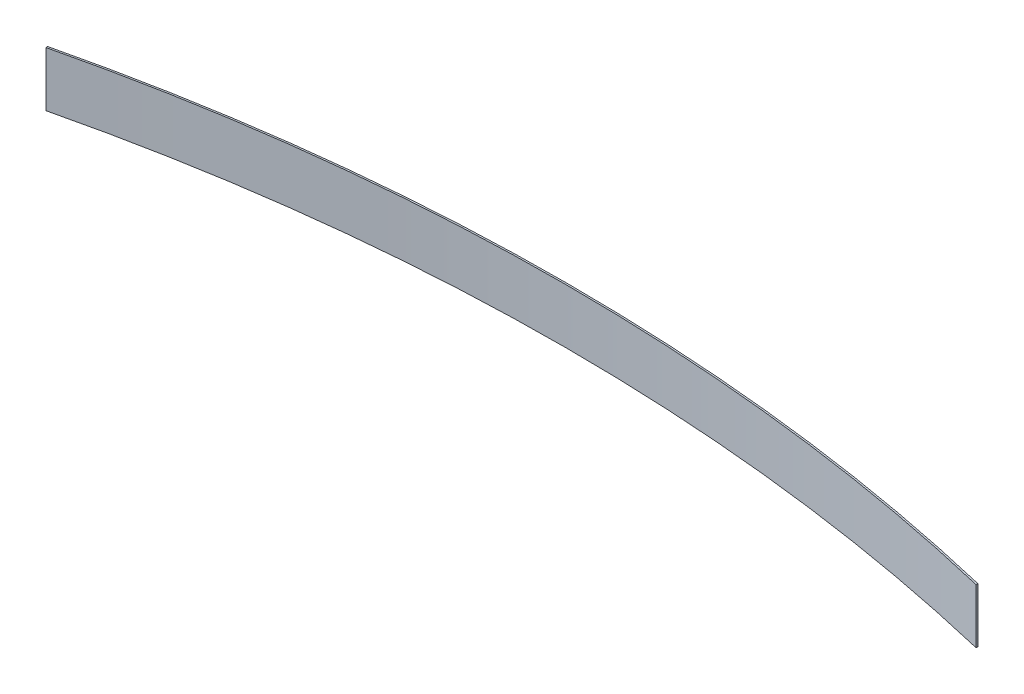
SolidWorks part; units mm, degrees
ref_plane "Front Plane" through (0, 0, 0) normal (0, 0, 1) x (1, 0, 0)
ref_plane "Top Plane" through (0, 0, 0) normal (0, 1, 0) x (1, 0, 0)
ref_plane "Right Plane" through (0, 0, 0) normal (1, 0, 0) x (0, 0, -1)
ref_plane "Plane1" through (1634.1695, 0, 389.9071) normal (0.9727, 0, 0.2321) x (0, 1, 0)
sketch "Sketch1" plane through (1634.1695, 0, 389.9071) normal (0.9727, 0, 0.2321) x (0, 1, 0)
  line L0 (0, -400.8519) -> (0, -404.0269)
  line L1 (0, -404.0269) -> (101.6, -404.0269)
  line L2 (101.6, -404.0269) -> (101.6, -400.8519)
  line L3 (101.6, -400.8519) -> (0, -400.8519)
  line L4 (101.6, 3320.2481) -> (0, 3320.2481) construction
revolve "Revolve1" add sketch "Sketch1" angle 26.839 about L4
